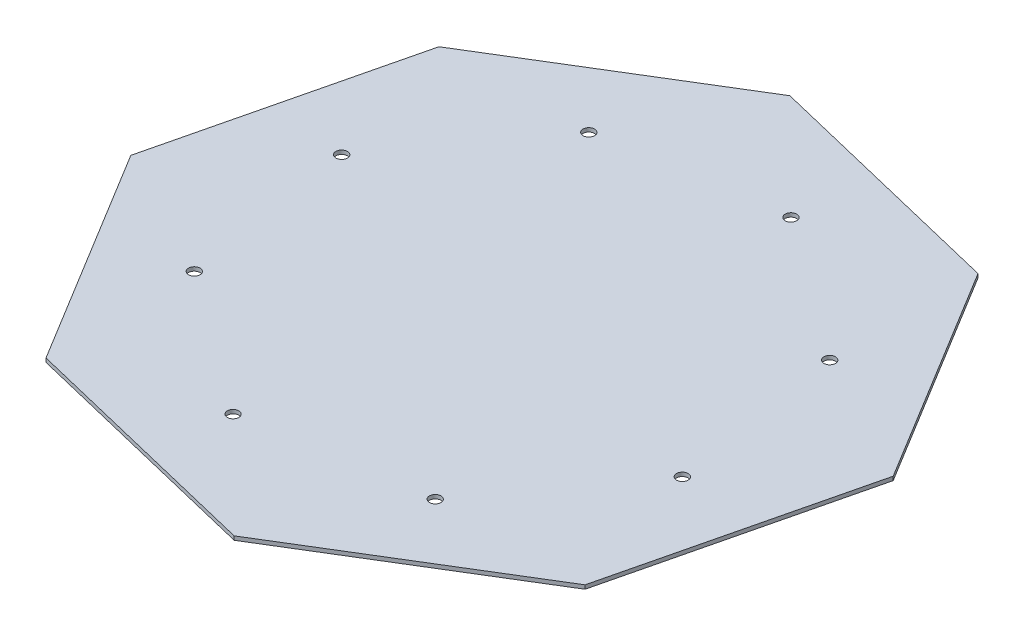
SolidWorks part; units mm, degrees
ref_plane "Front Plane" through (0, 0, 0) normal (0, 0, 1) x (1, 0, 0)
ref_plane "Top Plane" through (0, 0, 0) normal (0, 1, 0) x (1, 0, 0)
ref_plane "Right Plane" through (0, 0, 0) normal (1, 0, 0) x (0, 0, -1)
sketch "Sketch2" plane through (0, 0, 0) normal (0, 1, 0) x (1, 0, 0)
  line L0 (-13.4138, 85.5461) -> (-69.9752, 51.0052)
  line L7 (-85.5461, -13.4138) -> (-51.0052, -69.9752)
  line L8 (-51.0052, -69.9752) -> (13.4138, -85.5461)
  line L9 (13.4138, -85.5461) -> (69.9752, -51.0052)
  line L10 (69.9752, -51.0052) -> (85.5461, 13.4138)
  line L11 (85.5461, 13.4138) -> (51.0052, 69.9752)
  line L12 (51.0052, 69.9752) -> (-13.4138, 85.5461)
  line L13 (-69.9752, 51.0052) -> (-85.5461, -13.4138)
  line L14 (-77.7607, 18.7957) -> (-58.3205, 14.0968) construction
  line L15 (-68.2757, -41.6945) -> (-51.2067, -31.2709) construction
  line L16 (18.7957, 77.7607) -> (14.0968, 58.3205) construction
  line L17 (41.6945, -68.2757) -> (31.2709, -51.2067) construction
  line L18 (77.7607, -18.7957) -> (58.3205, -14.0968) construction
  line L19 (68.2757, 41.6945) -> (51.2067, 31.2709) construction
  line L20 (-18.7957, -77.7607) -> (-14.0968, -58.3205) construction
  line L21 (-41.6945, 68.2757) -> (-31.2709, 51.2067) construction
  circle A0 centre (0, 0) radius 80 construction
  circle A1 centre (-14.0968, -58.3205) radius 1.5
  circle A2 centre (14.0968, 58.3205) radius 1.5
  circle A3 centre (-58.3205, 14.0968) radius 1.5
  circle A4 centre (58.3205, -14.0968) radius 1.5
  circle A5 centre (-31.2709, 51.2067) radius 1.5
  circle A6 centre (51.2067, 31.2709) radius 1.5
  circle A7 centre (31.2709, -51.2067) radius 1.5
  circle A8 centre (-51.2067, -31.2709) radius 1.5
  point P36 (31.4559, -51.6739)
extrude "Boss-Extrude2" add sketch "Sketch2" along normal blind 1
